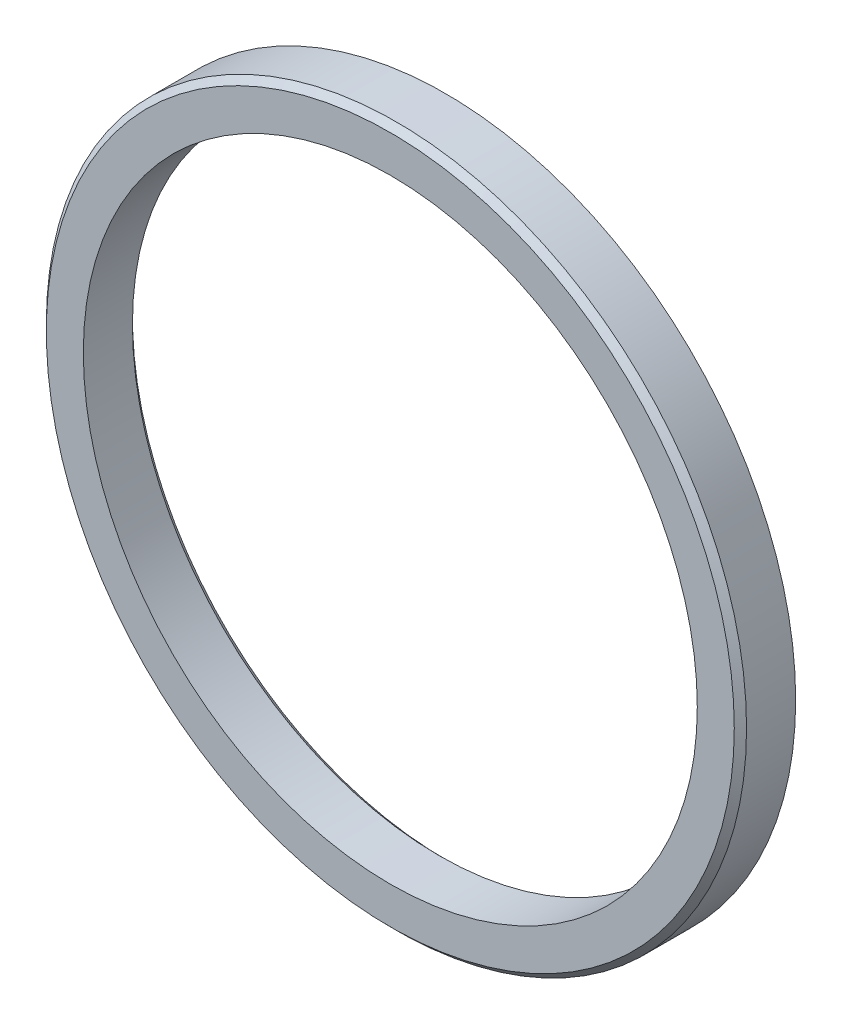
SolidWorks part; units mm, degrees
ref_plane "Front Plane" through (0, 0, 0) normal (0, 0, 1) x (1, 0, 0)
ref_plane "Top Plane" through (0, 0, 0) normal (0, 1, 0) x (1, 0, 0)
ref_plane "Right Plane" through (0, 0, 0) normal (1, 0, 0) x (0, 0, -1)
sketch "Sketch1" plane through (0, 0, 0) normal (1, 0, 0) x (0, 0, -1)
  line L0 (-66.6227, 0) -> (66.6227, 0) construction
  line L1 (-8, 100) -> (8, 100)
  line L2 (8, 100) -> (10, 102)
  line L3 (10, 102) -> (10, 114.05)
  line L4 (10, 114.05) -> (-6, 114.05)
  line L5 (-6, 114.05) -> (-8, 112.05)
  line L6 (-8, 112.05) -> (-8, 100)
  line L7 (0, -152.3213) -> (0, 152.3213) construction
  point P3 (0, 100)
  point P4 (0, 0)
  point P13 (0, 0)
  dimension "D1" = 45
  dimension "D2" = 45
  dimension "D3" = 2
  dimension "D4" = 2
  dimension "D5" = 200
  dimension "D6" = 228.1
  dimension "D7" = 18
revolve "Revolve1" add sketch "Sketch1" angle 360 about L0
